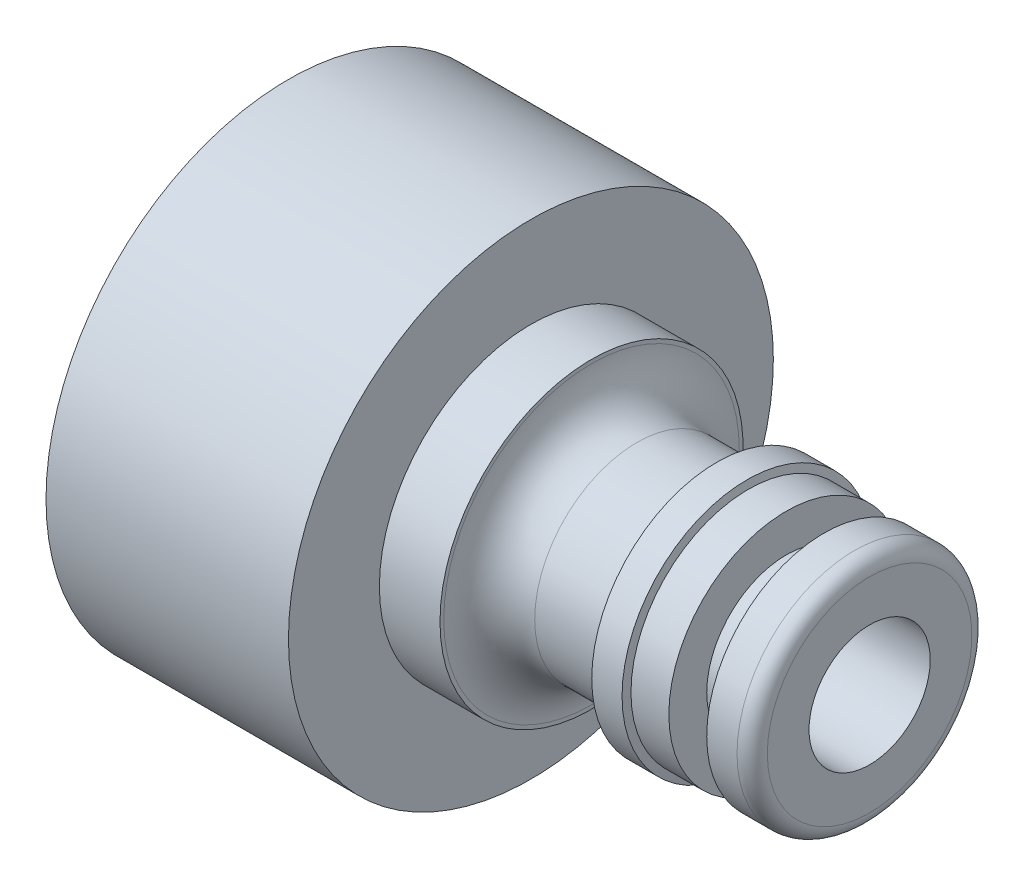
SolidWorks part; units mm, degrees
ref_plane "Plan de face" through (0, 0, 0) normal (0, 0, 1) x (1, 0, 0)
ref_plane "Plan de dessus" through (0, 0, 0) normal (0, 1, 0) x (1, 0, 0)
ref_plane "Plan de droite" through (0, 0, 0) normal (1, 0, 0) x (0, 0, -1)
sketch "Esquisse1" plane through (0, 0, 0) normal (0, 0, 1) x (1, 0, 0)
  line L0 (0, 0) -> (146.7014, 0) construction
  line L1 (0, 0) -> (0, 16)
  line L2 (0, 16) -> (16, 16)
  line L3 (16, 16) -> (16, 10)
  line L4 (16, 10) -> (20, 10)
  line L5 (20, 10) -> (20, 9.75)
  line L6 (23, 6.75) -> (28, 6.75)
  line L7 (28, 6.75) -> (28.2645, 8.25)
  line L8 (28.2645, 8.25) -> (30.2645, 8.25)
  line L9 (30.2645, 8.25) -> (30.3527, 7.75)
  line L10 (30.3527, 7.75) -> (32.8527, 7.75)
  line L11 (32.8527, 7.75) -> (32.8527, 5.25)
  line L12 (32.8527, 5.25) -> (35.3527, 5.25)
  line L13 (35.3527, 5.25) -> (35.3527, 7.75)
  line L14 (35.3527, 7.75) -> (37.3527, 7.75)
  line L15 (38.3527, 6.75) -> (38.3527, 0)
  line L16 (0, 0) -> (38.3527, 0)
  arc A0 (23, 6.75) -> (20, 9.75) centre (23, 9.75) cw
  arc A1 (38.3527, 6.75) -> (37.3527, 7.75) centre (37.3527, 6.75) ccw
  point P22 (38.3527, 7.75)
  dimension "D16" = 3
  dimension "D17" = 1
  dimension "D1" = 32
  dimension "D2" = 16
  dimension "D3" = 20
  dimension "D4" = 4
  dimension "D5" = 12
  dimension "D6" = 13.5
  dimension "D7" = 100
  dimension "D8" = 16.5
  dimension "D9" = 2
  dimension "D10" = 100
  dimension "D11" = 15.5
  dimension "D12" = 2.5
  dimension "D13" = 2.5
  dimension "D14" = 2.5
  dimension "D15" = 3
revolve "Révolution1" add sketch "Esquisse1" angle 360 about L0
sketch "Esquisse2" plane through (38.3527, 0, 0) normal (1, 0, 0) x (0, 0, -1)
  circle A0 centre (0, 0) radius 4
  dimension "D1" = 8
extrude "Enlèv. mat.-Extru.1" cut sketch "Esquisse2" against normal through all
sketch "Esquisse3" plane through (0, 0, 0) normal (-1, 0, 0) x (0, 0, 1)
  circle A0 centre (0, 0) radius 12.25
  dimension "D1" = 24.5
extrude "Enlèv. mat.-Extru.2" cut sketch "Esquisse3" against normal blind 12
